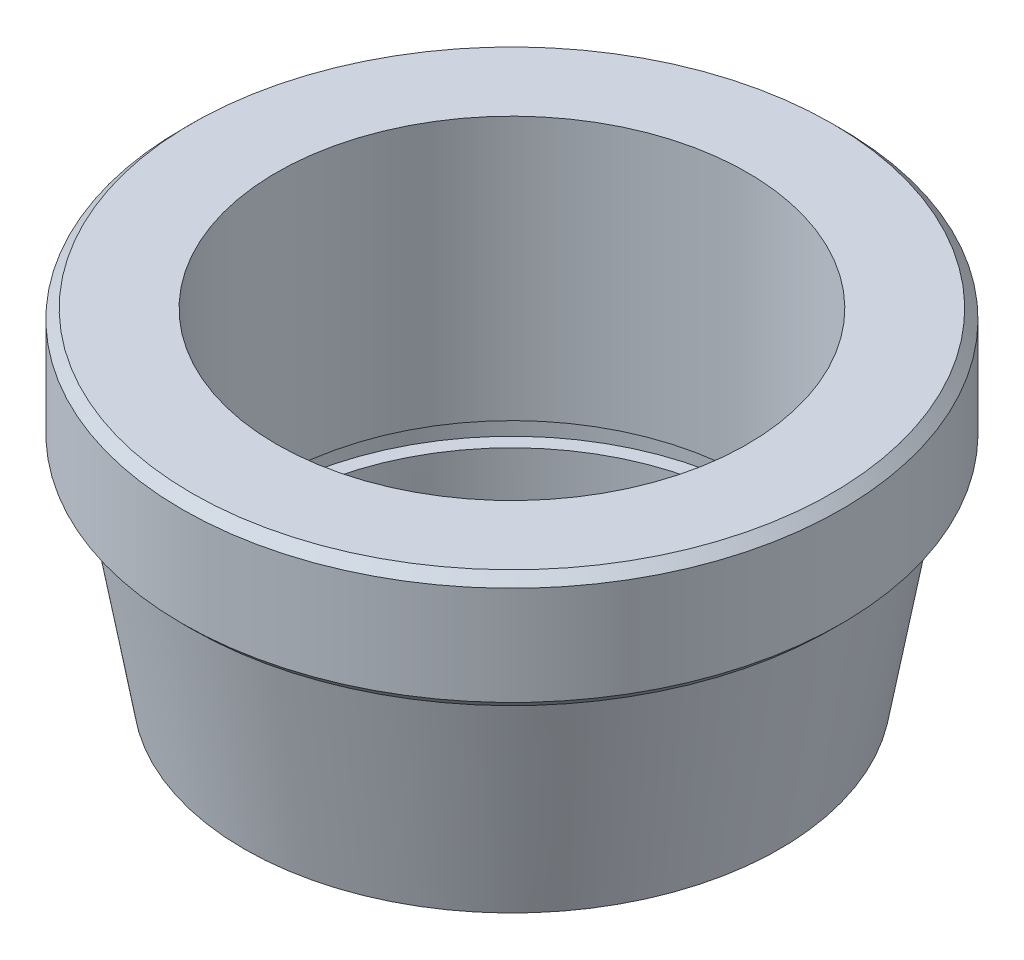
SolidWorks part; units mm, degrees
ref_plane "Přední rovina" through (0, 0, 0) normal (0, 0, 1) x (1, 0, 0)
ref_plane "Horní rovina" through (0, 0, 0) normal (0, 1, 0) x (1, 0, 0)
ref_plane "Pravá rovina" through (0, 0, 0) normal (1, 0, 0) x (0, 0, -1)
sketch "Skica1" plane through (0, 0, 0) normal (0, 1, 0) x (1, 0, 0)
  circle A0 centre (0, 0) radius 6.5
extrude "Přidat vysunutím1" add sketch "Skica1" against normal blind 4.6 draft 10
sketch "Skica2" plane through (0, 0, 0) normal (0, 1, 0) x (-1, 0, 0)
  circle A0 centre (0, 0) radius 7
extrude "Přidat vysunutím2" add sketch "Skica2" along normal blind 2.5
chamfer "Zkosení1" distance 0.2 angle 45 2 edges at (0, 0, 7) (0, 2.5, 7)
sketch "Skica3" plane through (0, 2.5, 0) normal (0, 1, 0) x (1, 0, 0)
  circle A0 centre (0, 0) radius 5
extrude "Odebrat vysunutím1" cut sketch "Skica3" against normal blind 2.5
sketch "Skica4" plane through (0, -4.6, 0) normal (0, -1, 0) x (1, 0, 0)
  circle A0 centre (0, 0) radius 5
extrude "Odebrat vysunutím2" cut sketch "Skica4" against normal up to surface (4.6 mm away)
sketch "Skica5" plane through (0, 0, 0) normal (0, 0, 1) x (1, 0, 0)
  line L0 (-5.6889, -4.6) -> (5.6889, -4.6) construction
  line L1 (-5.3, -3.6) -> (-5, -3.6)
  line L2 (-5.3, -3.6) -> (-5.3, -3.1)
  line L3 (-5.3, -3.1) -> (-5, -3.1)
  line L4 (-5, -3.6) -> (-5, -3.1)
  line L5 (-5, -4.6) -> (5, -4.6) construction
  point P8 (-3.25, -4.6)
  dimension "D1" = 0.3
  dimension "D2" = 0.5
  dimension "D3" = 1
  dimension "D5" = 5.3
ref_axis "Osa1" through (0, 2.5, 0) along (0, -1, 0)
revolve "Odebrat rotací1" cut sketch "Skica5" angle 360 about axis through (0, 2.5, 0) along (0, -1, 0)
